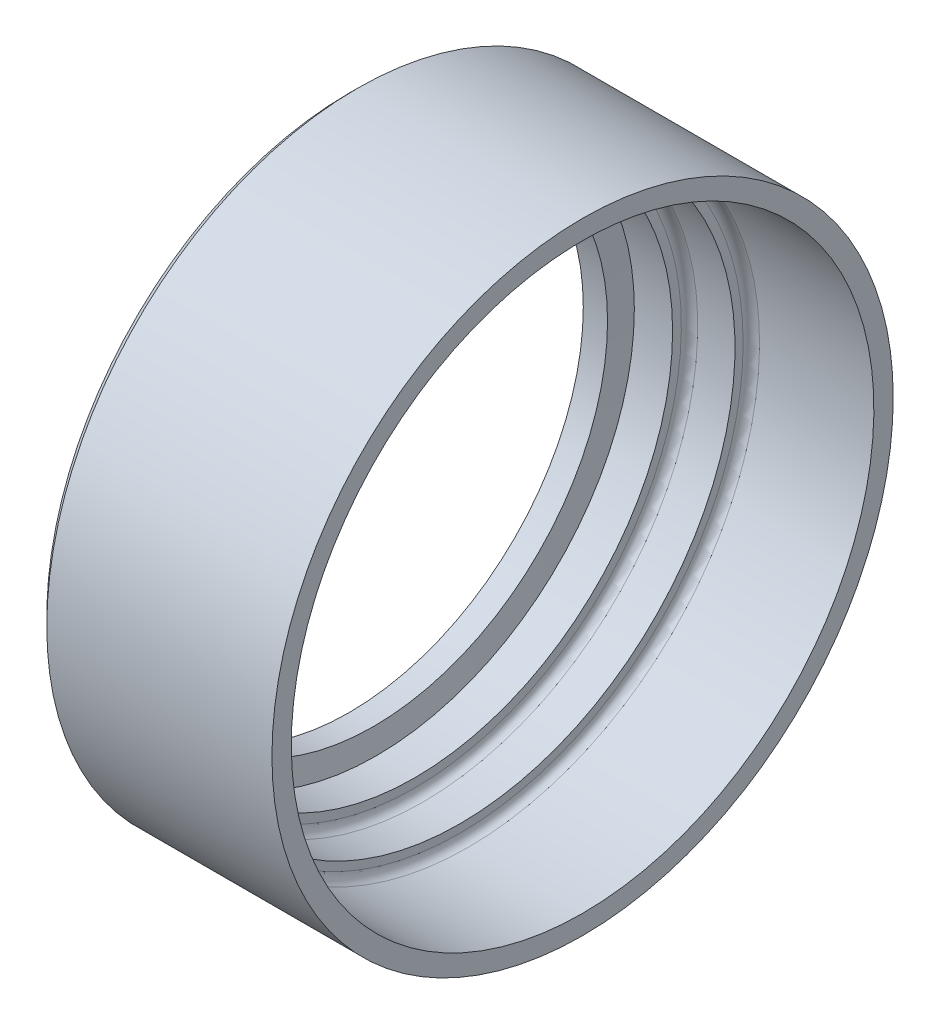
SolidWorks part; units mm, degrees
ref_plane "Front Plane" through (0, 0, 0) normal (0, 0, 1) x (1, 0, 0)
ref_plane "Top Plane" through (0, 0, 0) normal (0, 1, 0) x (1, 0, 0)
ref_plane "Right Plane" through (0, 0, 0) normal (1, 0, 0) x (0, 0, -1)
sketch "Sketch1" plane through (0, 0, 0) normal (0, 0, 1) x (1, 0, 0)
  line L0 (-269.2918, 25) -> (-282.1912, 25) construction
  line L1 (-269.2918, 25) -> (-282.1912, 25) construction
  line L2 (-283.8263, 0) -> (-206.5543, 0) construction
  line L3 (-278.4925, 25.025) -> (-282.2023, 25.025)
  line L4 (-282.2023, 25.025) -> (-282.479, 22.7018)
  line L5 (-269.2918, 25.025) -> (-282.1912, 25.025) construction
  line L6 (-282.479, 22.7018) -> (-284.831, 22.7018)
  line L7 (-284.831, 22.7018) -> (-284.831, 30.1306)
  line L8 (-284.831, 30.1306) -> (-262.1984, 30.1306)
  line L9 (-262.1984, 30.1306) -> (-262.1984, 28.2548)
  line L10 (-262.1984, 28.2548) -> (-274.0846, 28.2548)
  line L11 (-274.0846, 28.2548) -> (-274.0846, 26.67)
  line L12 (-274.0846, 26.67) -> (-278.4925, 26.67)
  line L13 (-278.4925, 26.67) -> (-278.4925, 25.025)
  arc A0 (-282.1912, 25) -> (-282.1912, -25) centre (-91.8874, 0) ccw construction
  arc A1 (-282.1912, 25) -> (-282.1912, -25) centre (-91.8874, 0) ccw construction
  dimension "D2" = 45.4036
  dimension "D3" = 53.34
  dimension "D4" = 56.5097
  dimension "D5" = 22.6327
  dimension "D6" = 11.8863
  dimension "D7" = 16.2941
  dimension "D8" = 19.9929
  dimension "D9" = 60.2611
  dimension "D1" = 0.025
revolve "Revolve1" add sketch "Sketch1" angle 360 about L2
fillet "Fillet1" radius 0.7937 2 edges at (-274.0846, -28.2548, 0) (-278.4925, -26.67, 0)
chamfer "Chamfer2" distance 0.7937 angle 45 1 edges at (-284.831, -30.1306, 0)
